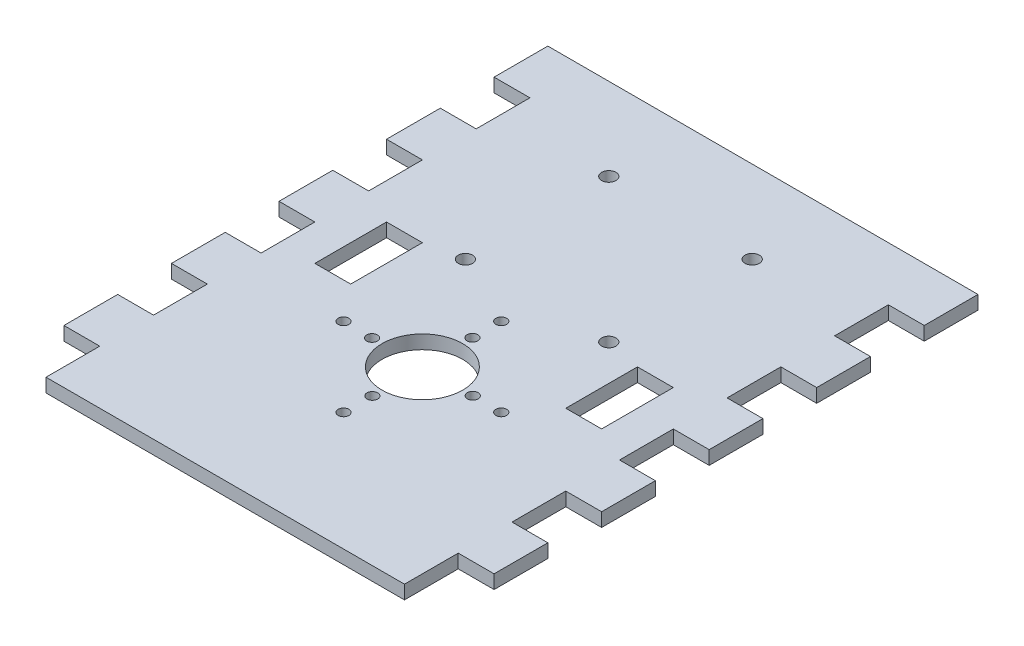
SolidWorks part; units mm, degrees
ref_plane "Front Plane" through (0, 0, 0) normal (0, 0, 1) x (1, 0, 0)
ref_plane "Top Plane" through (0, 0, 0) normal (0, 1, 0) x (1, 0, 0)
ref_plane "Right Plane" through (0, 0, 0) normal (1, 0, 0) x (0, 0, -1)
sketch "panelface" plane through (0, 0, 0) normal (0, 1, 0) x (1, 0, 0)
  line L0 (0, 20) -> (100, 20) construction
  line L1 (0, 0) -> (100, 0)
  line L2 (0, 0) -> (0, 150)
  line L3 (0, 150) -> (100, 150)
  line L4 (100, 0) -> (100, 150)
  line L5 (0, 55) -> (100, 55) construction
  line L6 (0, 130) -> (100, 130) construction
  line L7 (0, 95) -> (100, 95) construction
  line L8 (0, 75) -> (100, 75) construction
  line L9 (50, 150) -> (50, 0) construction
  line L10 (80, 85) -> (90, 65) construction
  line L11 (20, 65) -> (10, 65)
  line L12 (20, 65) -> (20, 85)
  line L13 (20, 85) -> (10, 85)
  line L14 (10, 65) -> (10, 85)
  line L15 (20, 65) -> (10, 85) construction
  line L16 (20, 85) -> (10, 65) construction
  line L17 (80, 65) -> (90, 85) construction
  line L18 (90, 65) -> (90, 85)
  line L19 (80, 85) -> (90, 85)
  line L20 (80, 65) -> (80, 85)
  line L21 (80, 65) -> (90, 65)
  circle A0 centre (50, 55) radius 11.25
  circle A1 centre (49.9598, 68.9999) radius 1.5
  circle A2 centre (63.9999, 55.0402) radius 1.5
  circle A3 centre (50.0402, 41.0001) radius 1.5
  circle A4 centre (36.0001, 54.9598) radius 1.5
  circle A5 centre (50, 33) radius 1.5
  circle A6 centre (28, 55) radius 1.5
  circle A7 centre (50, 77) radius 1.5
  circle A8 centre (72, 55) radius 1.5
  circle A9 centre (30, 127) radius 2
  circle A10 centre (70, 127) radius 2
  circle A11 centre (70, 87) radius 2
  circle A12 centre (30, 87) radius 2
  point P26 (50, 55)
  point P28 (15, 75)
  point P37 (85, 75)
  point P49 (50, 55)
extrude "panelx" add sketch "panelface" along normal blind 3.81
sketch "tabs" plane through (0, 0, 0) normal (0, -1, 0) x (1, 0, 0)
  line L1 (110, -150) -> (110, -135)
  line L2 (0, -150) -> (-10, -150)
  line L3 (0, -150) -> (0, -135)
  line L4 (0, -135) -> (-10, -135)
  line L6 (50, -150) -> (50, 0) construction
  line L7 (100, -150) -> (0, -150) construction
  line L8 (0, 0) -> (100, 0) construction
  line L9 (-10, -150) -> (-10, -135)
  line L10 (100, -135) -> (110, -135)
  line L11 (100, -150) -> (100, -135)
  line L12 (100, -150) -> (110, -150)
  line L13 (110, -120) -> (110, -105)
  line L14 (0, -120) -> (-10, -120)
  line L15 (0, -120) -> (0, -105)
  line L16 (0, -105) -> (-10, -105)
  line L17 (-10, -120) -> (-10, -105)
  line L18 (100, -105) -> (110, -105)
  line L19 (100, -120) -> (100, -105)
  line L20 (100, -120) -> (110, -120)
  line L21 (110, -90) -> (110, -75)
  line L22 (0, -90) -> (-10, -90)
  line L23 (0, -90) -> (0, -75)
  line L24 (0, -75) -> (-10, -75)
  line L25 (-10, -90) -> (-10, -75)
  line L26 (100, -75) -> (110, -75)
  line L27 (100, -90) -> (100, -75)
  line L28 (100, -90) -> (110, -90)
  line L29 (110, -60) -> (110, -45)
  line L30 (0, -60) -> (-10, -60)
  line L31 (0, -60) -> (0, -45)
  line L32 (0, -45) -> (-10, -45)
  line L33 (-10, -60) -> (-10, -45)
  line L34 (100, -45) -> (110, -45)
  line L35 (100, -60) -> (100, -45)
  line L36 (100, -60) -> (110, -60)
  line L37 (110, -30) -> (110, -15)
  line L38 (0, -30) -> (-10, -30)
  line L39 (0, -30) -> (0, -15)
  line L40 (0, -15) -> (-10, -15)
  line L41 (-10, -30) -> (-10, -15)
  line L42 (100, -15) -> (110, -15)
  line L43 (100, -30) -> (100, -15)
  line L44 (100, -30) -> (110, -30)
  dimension "D1" = 10
  dimension "D2" = 15
  dimension "D3" = 5
extrude "tabsx" add sketch "tabs" against normal up to surface (3.81 mm away)
equation "\"D1@panelface\" = \"sidespace@panelface\""
equation "\"D4@panelface\" = \"D2@panelface\""
